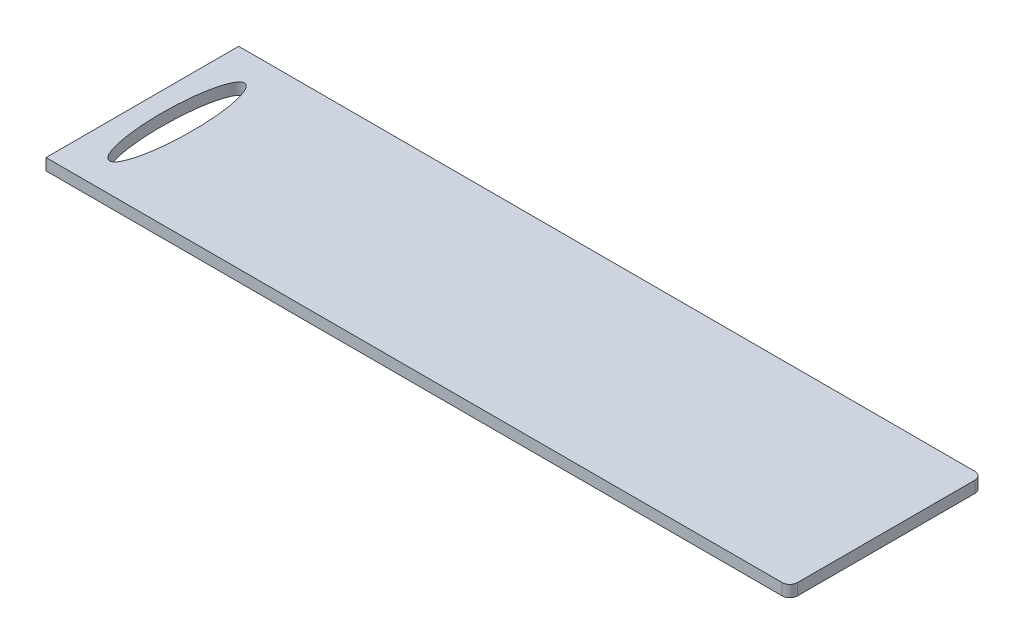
SolidWorks part; units mm, degrees
ref_plane "Спереди" through (0, 0, 0) normal (0, 0, 1) x (1, 0, 0)
ref_plane "Сверху" through (0, 0, 0) normal (0, 1, 0) x (1, 0, 0)
ref_plane "Справа" through (0, 0, 0) normal (1, 0, 0) x (0, 0, -1)
sketch "Эскиз1" plane through (0, 0, 0) normal (0, 1, 0) x (1, 0, 0)
  line L0 (127.5291, 14.4394) -> (94.0682, 14.4394) construction
  line L1 (-68.4709, 14.4394) -> (122.5291, 14.4394)
  line L2 (-68.4709, 14.4394) -> (-68.4709, -35.5606)
  line L3 (-68.4709, -35.5606) -> (122.5291, -35.5606)
  line L4 (124.5291, 12.4394) -> (124.5291, -33.5606)
  line L5 (124.5291, -35.5606) -> (124.5291, 14.4394) construction
  arc A0 (122.5291, -35.5606) -> (124.5291, -33.5606) centre (122.5291, -33.5606) ccw
  arc A1 (122.5291, 14.4394) -> (124.5291, 12.4394) centre (122.5291, 12.4394) cw
  ellipse E0 centre (-59.4709, -10.5606) end of major axis (-59.4709, 6.9394) minor radius 4
  point P10 (124.5291, -35.5606)
  point P13 (124.5291, 14.4394)
  dimension "D1" = 2
  dimension "D2" = 25
  dimension "D3" = 35
  dimension "D4" = 8
  dimension "D5" = 5
extrude "Бобышка-Вытянуть1" add sketch "Эскиз1" along normal blind 3
